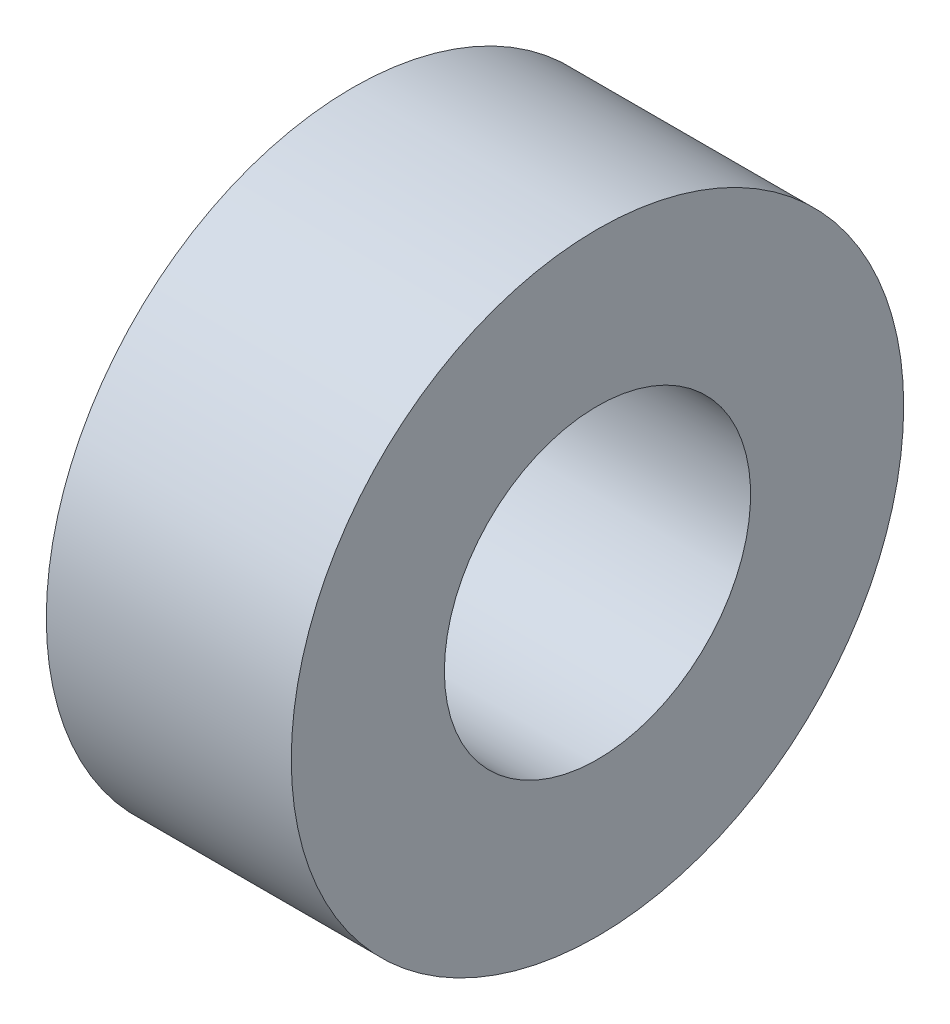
SolidWorks part; units mm, degrees
ref_plane "Plane1" through (0, 0, 0) normal (0, 0, 1) x (1, 0, 0)
ref_plane "Plane2" through (0, 0, 0) normal (0, 1, 0) x (1, 0, 0)
ref_plane "Plane3" through (0, 0, 0) normal (1, 0, 0) x (0, 0, -1)
sketch "Esquisse1" plane through (0, 0, 0) normal (0, 0, 1) x (1, 0, 0)
  line L0 (0, 2.5) -> (4, 2.5)
  line L1 (0, 2.5) -> (0, 5)
  line L2 (4, 5) -> (0, 5)
  line L3 (4, 5) -> (4, 2.5)
  line L4 (-2, 0) -> (7.5, 0) construction
  dimension "D1" = 5
  dimension "D2" = 2.5
revolve "Base-Révolution" add sketch "Esquisse1" angle 360 about L4
chamfer "Chanfrein1" distance 0.2 angle 46
